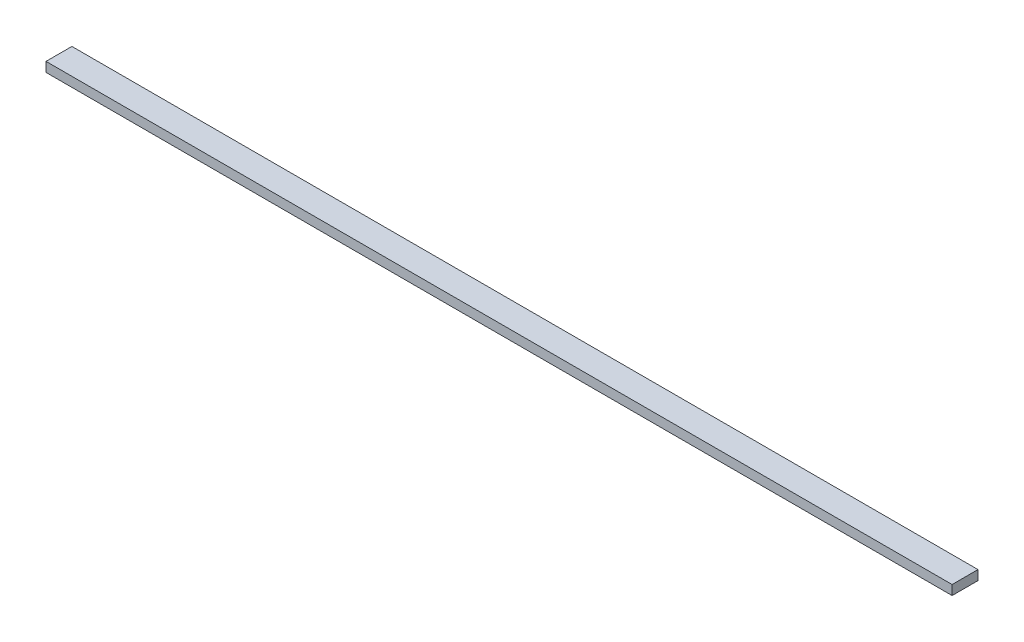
SolidWorks part; units mm, degrees
ref_plane "Front Plane" through (0, 0, 0) normal (0, 0, 1) x (1, 0, 0)
ref_plane "Top Plane" through (0, 0, 0) normal (0, 1, 0) x (1, 0, 0)
ref_plane "Right Plane" through (0, 0, 0) normal (1, 0, 0) x (0, 0, -1)
sketch "Sketch1" plane through (0, 0, 0) normal (0, 1, 0) x (1, 0, 0)
  line L1 (-300.0375, -8.5725) -> (300.0375, -8.5725)
  line L2 (-300.0375, -8.5725) -> (-300.0375, 8.5725)
  line L3 (-300.0375, 8.5725) -> (300.0375, 8.5725)
  line L4 (300.0375, -8.5725) -> (300.0375, 8.5725)
  line L5 (-300.0375, -8.5725) -> (300.0375, 8.5725) construction
  line L6 (-300.0375, 8.5725) -> (300.0375, -8.5725) construction
  point P0 (0, 0)
  dimension "D1" = 17.145
  dimension "D2" = 600.075
extrude "Boss-Extrude1" add sketch "Sketch1" along normal blind 6.35
